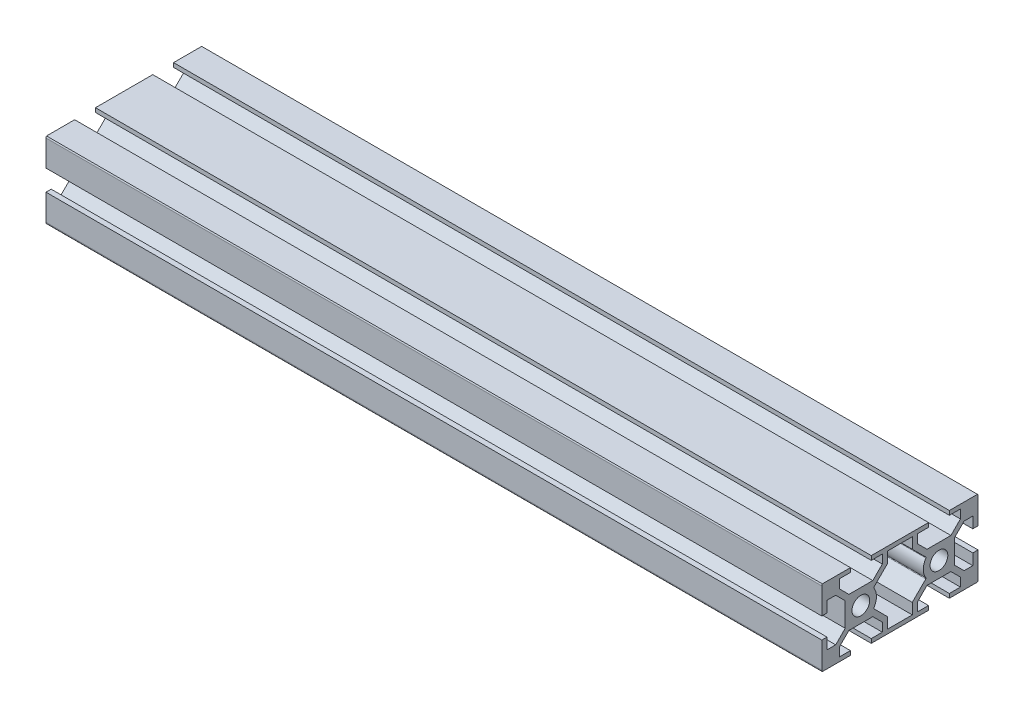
SolidWorks part; units mm, degrees
ref_plane "Front Plane" through (0, 0, 0) normal (0, 0, 1) x (1, 0, 0)
ref_plane "Top Plane" through (0, 0, 0) normal (0, 1, 0) x (1, 0, 0)
ref_plane "Right Plane" through (0, 0, 0) normal (1, 0, 0) x (0, 0, -1)
sketch "Sketch1" plane through (0, 0, 0) normal (1, 0, 0) x (0, 0, -1)
  line L0 (-4.75, 8.8358) -> (-9.934, 3.6518)
  line L1 (-4.75, 13) -> (-4.75, 8.8358)
  line L2 (4.75, 13) -> (-4.75, 13)
  line L3 (4.75, 8.8358) -> (4.75, 13)
  line L4 (9.934, 3.6518) -> (4.75, 8.8358)
  line L5 (4.75, -8.8358) -> (9.934, -3.6518)
  line L6 (4.75, -13) -> (4.75, -8.8358)
  line L7 (-4.75, -13) -> (4.75, -13)
  line L8 (-4.75, -8.8358) -> (-4.75, -13)
  line L9 (-9.934, -3.6518) -> (-4.75, -8.8358)
  line L10 (-30, 14) -> (-30, 4)
  line L11 (-30, 4) -> (-28, 4)
  line L12 (-28, 4) -> (-28, 8.25)
  line L13 (-28, 8.25) -> (-24.6642, 8.25)
  line L14 (-24.6642, 8.25) -> (-21, 4.5858)
  line L15 (-21, 4.5858) -> (-21, -4.5858)
  line L19 (-21, -4.5858) -> (-24.6642, -8.25)
  line L20 (-24.6642, -8.25) -> (-28, -8.25)
  line L21 (-28, -8.25) -> (-28, -4)
  line L22 (-28, -4) -> (-30, -4)
  line L23 (-30, -4) -> (-30, -14)
  line L24 (-29.8, -14.6) -> (-19, -14.6)
  line L25 (-19, -14.6) -> (-19, -13)
  line L26 (-19, -13) -> (-23.25, -13)
  line L27 (-23.25, -13) -> (-23.25, -9.6642)
  line L28 (-23.25, -9.6642) -> (-19.5858, -6)
  line L29 (-19.5858, -6) -> (-10.4142, -6)
  line L33 (-10.4142, -6) -> (-6.75, -9.6642)
  line L34 (-6.75, -9.6642) -> (-6.75, -13)
  line L35 (-6.75, -13) -> (-11, -13)
  line L36 (-11, -13) -> (-11, -14.6)
  line L37 (-11, -14.6) -> (11, -14.6)
  line L38 (11, -14.6) -> (11, -13)
  line L39 (11, -13) -> (6.75, -13)
  line L40 (6.75, -13) -> (6.75, -9.6642)
  line L41 (6.75, -9.6642) -> (10.4142, -6)
  line L42 (10.4142, -6) -> (19.5858, -6)
  line L46 (19.5858, -6) -> (23.25, -9.6642)
  line L47 (23.25, -9.6642) -> (23.25, -13)
  line L48 (23.25, -13) -> (19, -13)
  line L49 (19, -13) -> (19, -14.6)
  line L50 (19, -14.6) -> (29.8, -14.6)
  line L51 (30, -14) -> (30, -4)
  line L52 (30, -4) -> (28, -4)
  line L53 (28, -4) -> (28, -8.25)
  line L54 (28, -8.25) -> (24.6642, -8.25)
  line L55 (24.6642, -8.25) -> (21, -4.5858)
  line L59 (21, -4.5858) -> (21, 4.5858)
  line L60 (21, 4.5858) -> (24.6642, 8.25)
  line L61 (24.6642, 8.25) -> (28, 8.25)
  line L62 (28, 8.25) -> (28, 4)
  line L63 (28, 4) -> (30, 4)
  line L64 (30, 4) -> (30, 14)
  line L65 (29.8, 14.6) -> (19, 14.6)
  line L66 (19, 14.6) -> (19, 13)
  line L67 (19, 13) -> (23.25, 13)
  line L68 (23.25, 13) -> (23.25, 9.6642)
  line L69 (23.25, 9.6642) -> (19.5858, 6)
  line L73 (19.5858, 6) -> (10.4142, 6)
  line L74 (10.4142, 6) -> (6.75, 9.6642)
  line L75 (6.75, 9.6642) -> (6.75, 13)
  line L76 (6.75, 13) -> (11, 13)
  line L77 (11, 13) -> (11, 14.6)
  line L78 (11, 14.6) -> (-11, 14.6)
  line L79 (-11, 14.6) -> (-11, 13)
  line L80 (-11, 13) -> (-6.75, 13)
  line L81 (-6.75, 13) -> (-6.75, 9.6642)
  line L82 (-6.75, 9.6642) -> (-10.4142, 6)
  line L86 (-10.4142, 6) -> (-19.5858, 6)
  line L87 (-19.5858, 6) -> (-23.25, 9.6642)
  line L88 (-23.25, 9.6642) -> (-23.25, 13)
  line L89 (-23.25, 13) -> (-19, 13)
  line L90 (-19, 13) -> (-19, 14.6)
  line L91 (-19, 14.6) -> (-29.8, 14.6)
  circle A0 centre (-15, 0) radius 3.4
  arc A1 (-30, -14) -> (-29.8, -14.6) centre (-29, -14) ccw
  arc A2 (29.8, -14.6) -> (30, -14) centre (29, -14) ccw
  arc A3 (30, 14) -> (29.8, 14.6) centre (29, 14) ccw
  arc A4 (-29.8, 14.6) -> (-30, 14) centre (-29, 14) ccw
  circle A5 centre (15, 0) radius 3.4
  arc A6 (-9.9732, -3.2759) -> (-9.934, -3.6518) centre (-9.7219, -3.4397) ccw
  arc A7 (-9.9732, -3.2759) -> (-9.9732, 3.2759) centre (-15, 0) ccw
  arc A8 (-9.934, 3.6518) -> (-9.9732, 3.2759) centre (-9.7219, 3.4397) ccw
  arc A9 (9.9732, 3.2759) -> (9.934, 3.6518) centre (9.7219, 3.4397) ccw
  arc A10 (9.9732, 3.2759) -> (9.9732, -3.2759) centre (15, 0) ccw
  arc A11 (9.934, -3.6518) -> (9.9732, -3.2759) centre (9.7219, -3.4397) ccw
  dimension "A" = 60
  dimension "T" = 29.2
extrude "Boss-Extrude1" add sketch "Sketch1" along normal blind 298
ref_plane "Plane1" through (0, 9.6, 0) normal (0, 1, 0) x (1, 0, 0)
ref_plane "Plane2" through (0, 0, 0) normal (1, 0, 0) x (0, 0, -1)
ref_plane "Plane3" through (298, 0, 0) normal (1, 0, 0) x (0, 0, -1)
ref_plane "Plane4" through (7, 0, 0) normal (1, 0, 0) x (0, 0, -1)
ref_plane "Plane5" through (20, 0, 0) normal (1, 0, 0) x (0, 0, -1)
ref_plane "Plane6" through (33, 0, 0) normal (1, 0, 0) x (0, 0, -1)
ref_plane "Plane7" through (46, 0, 0) normal (1, 0, 0) x (0, 0, -1)
ref_plane "Plane8" through (59, 0, 0) normal (1, 0, 0) x (0, 0, -1)
sketch "Sketch2" [suppressed] plane through (7, 0, 0) normal (1, 0, 0) x (0, 0, -1)
  line L0 (15, -14.6) -> (18.25, -14.6)
  line L1 (18.25, -14.6) -> (18.25, 6)
  line L2 (18.25, 6) -> (20.5, 6)
  line L3 (20.5, 6) -> (20.5, 14.6)
  line L4 (20.5, 14.6) -> (15, 14.6)
  line L5 (15, 14.6) -> (15, -14.6) construction
  line L6 (15, 14.6) -> (15, -14.6)
  point P6 (15, 0)
  dimension "T" = 29.2
  dimension "FIX_3" = 8.6
  dimension "D1._s" = 11
  dimension "D_s" = 6.5
  dimension "FIX_4" = 15
revolve "Cut-Revolve1" [suppressed] cut sketch "Sketch2" angle 360 about L5
mirror "Mirror1" [suppressed] about plane through (0, 0, 0) normal (0, 0, 1)
sketch "Sketch3" [suppressed] plane through (20, 0, 0) normal (1, 0, 0) x (0, 0, -1)
  line L0 (15, -14.6) -> (18.25, -14.6)
  line L1 (18.25, -14.6) -> (18.25, 6)
  line L2 (18.25, 6) -> (20.5, 6)
  line L3 (20.5, 6) -> (20.5, 14.6)
  line L4 (20.5, 14.6) -> (15, 14.6)
  line L5 (15, 14.6) -> (15, -14.6) construction
  line L6 (15, 14.6) -> (15, -14.6)
  point P6 (15, 0)
  dimension "T" = 29.2
  dimension "FIX_6" = 8.6
  dimension "D1._s" = 11
  dimension "D_s" = 6.5
  dimension "FIX_7" = 15
revolve "Cut-Revolve2" [suppressed] cut sketch "Sketch3" angle 360 about L5
mirror "Mirror2" [suppressed] about plane through (0, 0, 0) normal (0, 0, 1)
sketch "Sketch4" [suppressed] plane through (33, 0, 0) normal (1, 0, 0) x (0, 0, -1)
  line L0 (15, -14.6) -> (18.25, -14.6)
  line L1 (18.25, -14.6) -> (18.25, 6)
  line L2 (18.25, 6) -> (20.5, 6)
  line L3 (20.5, 6) -> (20.5, 14.6)
  line L4 (20.5, 14.6) -> (15, 14.6)
  line L5 (15, 14.6) -> (15, -14.6) construction
  line L6 (15, 14.6) -> (15, -14.6)
  point P6 (15, 0)
  dimension "T" = 29.2
  dimension "FIX_9" = 8.6
  dimension "D1._s" = 11
  dimension "D_s" = 6.5
  dimension "FIX_10" = 15
revolve "Cut-Revolve3" [suppressed] cut sketch "Sketch4" angle 360 about L5
mirror "Mirror3" [suppressed] about plane through (0, 0, 0) normal (0, 0, 1)
sketch "Sketch5" [suppressed] plane through (46, 0, 0) normal (1, 0, 0) x (0, 0, -1)
  line L0 (15, -14.6) -> (18.25, -14.6)
  line L1 (18.25, -14.6) -> (18.25, 6)
  line L2 (18.25, 6) -> (20.5, 6)
  line L3 (20.5, 6) -> (20.5, 14.6)
  line L4 (20.5, 14.6) -> (15, 14.6)
  line L5 (15, 14.6) -> (15, -14.6) construction
  line L6 (15, 14.6) -> (15, -14.6)
  point P6 (15, 0)
  dimension "T" = 29.2
  dimension "FIX_12" = 8.6
  dimension "D1._s" = 11
  dimension "D_s" = 6.5
  dimension "FIX_13" = 15
revolve "Cut-Revolve4" [suppressed] cut sketch "Sketch5" angle 360 about L5
mirror "Mirror4" [suppressed] about plane through (0, 0, 0) normal (0, 0, 1)
sketch "Sketch6" [suppressed] plane through (59, 0, 0) normal (1, 0, 0) x (0, 0, -1)
  line L0 (15, -14.6) -> (18.25, -14.6)
  line L1 (18.25, -14.6) -> (18.25, 6)
  line L2 (18.25, 6) -> (20.5, 6)
  line L3 (20.5, 6) -> (20.5, 14.6)
  line L4 (20.5, 14.6) -> (15, 14.6)
  line L5 (15, 14.6) -> (15, -14.6) construction
  line L6 (15, 14.6) -> (15, -14.6)
  point P6 (15, 0)
  dimension "T" = 29.2
  dimension "FIX_15" = 8.6
  dimension "D1._s" = 11
  dimension "D_s" = 6.5
  dimension "FIX_16" = 15
revolve "Cut-Revolve5" [suppressed] cut sketch "Sketch6" angle 360 about L5
mirror "Mirror5" [suppressed] about plane through (0, 0, 0) normal (0, 0, 1)
sketch "Sketch7" [suppressed] plane through (0, 9.6, 0) normal (0, 1, 0) x (1, 0, 0)
  circle A0 centre (7, -15) radius 4
  circle A1 centre (7, 15) radius 4
  dimension "D" = 8
  dimension "AV" = 7
  dimension "FIX_18" = 30
  dimension "FIX_19" = 15
extrude "Cut-Extrude1" [suppressed] cut sketch "Sketch7" against normal blind 29.2
sketch "Sketch8" [suppressed] plane through (0, 9.6, 0) normal (0, 1, 0) x (1, 0, 0)
  circle A0 centre (17, -15) radius 4
  circle A1 centre (17, 15) radius 4
  dimension "D" = 8
  dimension "BV" = 17
  dimension "FIX_20" = 15
  dimension "FIX_21" = 30
extrude "Cut-Extrude2" [suppressed] cut sketch "Sketch8" against normal blind 29.2
sketch "Sketch9" [suppressed] plane through (0, 9.6, 0) normal (0, 1, 0) x (1, 0, 0)
  circle A0 centre (27, -15) radius 4
  circle A1 centre (27, 15) radius 4
  dimension "D" = 8
  dimension "CV" = 27
  dimension "FIX_22" = 30
  dimension "FIX_23" = 15
extrude "Cut-Extrude3" [suppressed] cut sketch "Sketch9" against normal blind 29.2
sketch "Sketch10" [suppressed] plane through (0, 9.6, 0) normal (0, 1, 0) x (1, 0, 0)
  circle A0 centre (37, -15) radius 4
  circle A1 centre (37, 15) radius 4
  dimension "D" = 8
  dimension "DV" = 37
  dimension "FIX_24" = 15
  dimension "FIX_25" = 30
extrude "Cut-Extrude4" [suppressed] cut sketch "Sketch10" against normal blind 29.2
sketch "Sketch11" [suppressed] plane through (0, 9.6, 0) normal (0, 1, 0) x (1, 0, 0)
  circle A0 centre (47, -15) radius 4
  circle A1 centre (47, 15) radius 4
  dimension "D" = 8
  dimension "EV" = 47
  dimension "FIX_26" = 15
  dimension "FIX_27" = 30
extrude "Cut-Extrude5" [suppressed] cut sketch "Sketch11" against normal blind 29.2
sketch "Sketch12" [suppressed] plane through (0, 0, 0) normal (1, 0, 0) x (0, 0, -1)
  circle A0 centre (-15, 0) radius 3.4
  circle A1 centre (15, 0) radius 3.4
  dimension "FIX_28" = 6.8
  dimension "FIX_29" = 30
  dimension "FIX_31" = 15
extrude "Boss-Extrude2" [suppressed] add sketch "Sketch12" along normal blind 24
hole_wizard "Tapped Hole1" positions "Sketch14" profile "Sketch13" tap size "M8x1.25" standard "JIS"
sketch "Sketch14" [suppressed] plane through (0, 0, 0) normal (1, 0, 0) x (0, 0, -1)
  point P4 (15, 0)
  point P6 (-15, 0)
  dimension "FIX_33" = 30
  dimension "FIX_34" = 15
sketch "Sketch13" [suppressed] plane through (0, 0, -15) normal (0, 1, 0) x (0, 0, 1)
  line L0 (0, 0) -> (0, 24)
  line L1 (0, 24) -> (3.4, 24)
  line L2 (3.4, 24) -> (3.4, 0)
  line L5 (3.4, 0) -> (0, 0)
  line L11 (0, -6.35) -> (0, 107.95) construction
  dimension "Thru Tap Drill Dia." = 6.8
  dimension "Thru Tap Drill Depth" = 24
sketch "Sketch15" [suppressed] plane through (100, 0, 0) normal (1, 0, 0) x (0, 0, -1)
  circle A0 centre (-15, 0) radius 3.4
  circle A1 centre (15, 0) radius 3.4
  dimension "FIX_36" = 6.8
  dimension "FIX_35" = 30
  dimension "FIX_37" = 15
extrude "Boss-Extrude3" [suppressed] add sketch "Sketch15" against normal blind 24
hole_wizard "Tapped Hole2" positions "Sketch17" profile "Sketch16" tap size "M8x1.25" standard "JIS"
sketch "Sketch17" [suppressed] plane through (100, 0, 0) normal (1, 0, 0) x (0, 0, -1)
  point P4 (-15, 0)
  point P6 (15, 0)
  dimension "FIX_39" = 30
  dimension "FIX_40" = 15
sketch "Sketch16" [suppressed] plane through (100, 0, 15) normal (0, 1, 0) x (0, 0, -1)
  line L0 (0, 0) -> (0, 24)
  line L1 (0, 24) -> (3.4, 24)
  line L2 (3.4, 24) -> (3.4, 0)
  line L5 (3.4, 0) -> (0, 0)
  line L11 (0, -6.35) -> (0, 107.95) construction
  dimension "Thru Tap Drill Dia." = 6.8
  dimension "Thru Tap Drill Depth" = 24
sketch "Sketch18" [suppressed] plane through (0, 0, 0) normal (1, 0, 0) x (0, 0, -1)
  circle A1 centre (-15, 0) radius 3.4
  circle A2 centre (15, 0) radius 3.4
  dimension "FIX_41" = 6.8
  dimension "FIX_42" = 30
  dimension "FIX_43" = 15
extrude "Boss-Extrude4" [suppressed] add sketch "Sketch18" along normal blind 24
sketch "Sketch19" [suppressed] plane through (100, 0, 0) normal (1, 0, 0) x (0, 0, -1)
  circle A0 centre (-15, 0) radius 3.4
  circle A1 centre (15, 0) radius 3.4
  dimension "FIX_46" = 6.8
  dimension "FIX_45" = 30
  dimension "FIX_47" = 15
extrude "Boss-Extrude5" [suppressed] add sketch "Sketch19" against normal blind 24
hole_wizard "Tapped Hole3" positions "Sketch21" profile "Sketch20" tap size "M8x1.25" standard "JIS"
sketch "Sketch21" [suppressed] plane through (0, 0, 0) normal (1, 0, 0) x (0, 0, -1)
  point P4 (-15, 0)
  point P6 (15, 0)
  dimension "FIX_49" = 30
  dimension "FIX_50" = 15
sketch "Sketch20" [suppressed] plane through (0, 0, 15) normal (0, 1, 0) x (0, 0, 1)
  line L0 (0, 0) -> (0, 24)
  line L1 (0, 24) -> (3.4, 24)
  line L2 (3.4, 24) -> (3.4, 0)
  line L5 (3.4, 0) -> (0, 0)
  line L11 (0, -6.35) -> (0, 107.95) construction
  dimension "Thru Tap Drill Dia." = 6.8
  dimension "Thru Tap Drill Depth" = 24
hole_wizard "Tapped Hole4" positions "Sketch23" profile "Sketch22" tap size "M8x1.25" standard "JIS"
sketch "Sketch23" [suppressed] plane through (100, 0, 0) normal (1, 0, 0) x (0, 0, -1)
  point P4 (-15, 0)
  point P6 (15, 0)
  dimension "FIX_51" = 30
  dimension "FIX_52" = 15
sketch "Sketch22" [suppressed] plane through (100, 0, 15) normal (0, 1, 0) x (0, 0, -1)
  line L0 (0, 0) -> (0, 24)
  line L1 (0, 24) -> (3.4, 24)
  line L2 (3.4, 24) -> (3.4, 0)
  line L5 (3.4, 0) -> (0, 0)
  line L11 (0, -6.35) -> (0, 107.95) construction
  dimension "Thru Tap Drill Dia." = 6.8
  dimension "Thru Tap Drill Depth" = 24
